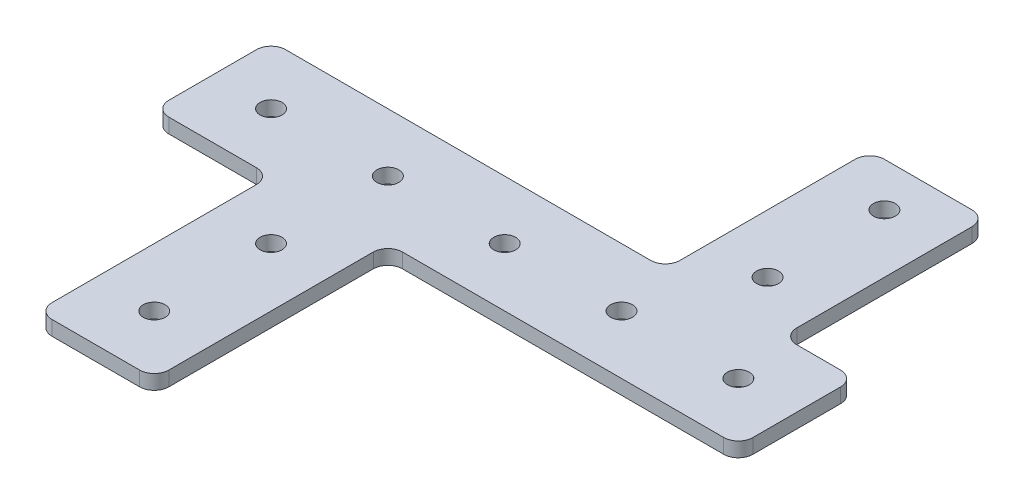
SolidWorks part; units mm, degrees
ref_plane "Front Plane" through (0, 0, 0) normal (0, 0, 1) x (1, 0, 0)
ref_plane "Top Plane" through (0, 0, 0) normal (0, 1, 0) x (1, 0, 0)
ref_plane "Right Plane" through (0, 0, 0) normal (1, 0, 0) x (0, 0, -1)
sketch "Sketch1" plane through (0, 0, 0) normal (0, 1, 0) x (1, 0, 0)
  line L0 (0, -44.45) -> (0, 0)
  line L1 (0, 0) -> (25.4, 0)
  line L2 (25.4, 0) -> (25.4, -44.45)
  line L3 (25.4, -44.45) -> (41.275, -44.45)
  line L4 (41.275, -44.45) -> (41.275, -69.85)
  line L5 (41.275, -69.85) -> (-34.925, -69.85)
  line L6 (-34.925, -69.85) -> (-34.925, -44.45) construction
  line L7 (-34.925, -44.45) -> (0, -44.45)
  line L8 (-85.725, -57.15) -> (41.275, -57.15) construction
  line L9 (12.7, 0) -> (12.7, -48.7327) construction
  line L10 (-34.925, -44.45) -> (-85.725, -44.45)
  line L11 (-85.725, -44.45) -> (-85.725, -69.85)
  line L12 (-85.725, -69.85) -> (-60.325, -69.85)
  line L13 (-60.325, -69.85) -> (-60.325, -120.65)
  line L14 (-60.325, -120.65) -> (-34.925, -120.65)
  line L15 (-34.925, -120.65) -> (-34.925, -69.85)
  circle A0 centre (-22.225, -57.15) radius 2.3812
  circle A1 centre (3.175, -57.15) radius 2.3812
  circle A2 centre (28.575, -57.15) radius 2.3812
  circle A3 centre (-73.025, -57.15) radius 2.3813
  circle A4 centre (12.7, -9.525) radius 2.3813
  circle A5 centre (12.7, -34.925) radius 2.3812
  circle A6 centre (-47.625, -57.15) radius 2.3812
  circle A8 centre (-47.625, -82.55) radius 2.3812
  circle A9 centre (-47.625, -107.95) radius 2.3812
  point P39 (-47.625, -120.65)
  dimension "D8" = 4.7625
  dimension "D3" = 15.875
  dimension "D1" = 25.4
  dimension "D2" = 76.2
  dimension "D4" = 69.85
  dimension "D5" = 12.7
  dimension "D6" = 25.4
  dimension "D7" = 25.4
  dimension "D9" = 9.525
  dimension "D10" = 25.4
  dimension "D11" = 50.8
  dimension "D13" = 76.2
  dimension "D14" = 12.7
  dimension "D15" = 25.4
  dimension "D16" = 12.7
  dimension "D17" = 25.4
extrude "Boss-Extrude1" add sketch "Sketch1" along normal blind 3.175
fillet "Fillet1" radius 3.175 12 edges at (41.275, 1.5875, 69.85) (41.275, 1.5875, 44.45) (25.4, 1.5875, 44.45) (25.4, 1.5875, 0) (0, 1.5875, 0) (0, 1.5875, 44.45) (-34.925, 1.5875, 120.65) (-60.325, 1.5875, 120.65) (-60.325, 1.5875, 69.85) (-85.725, 1.5875, 69.85) (-85.725, 1.5875, 44.45) (-34.925, 1.5875, 69.85)
